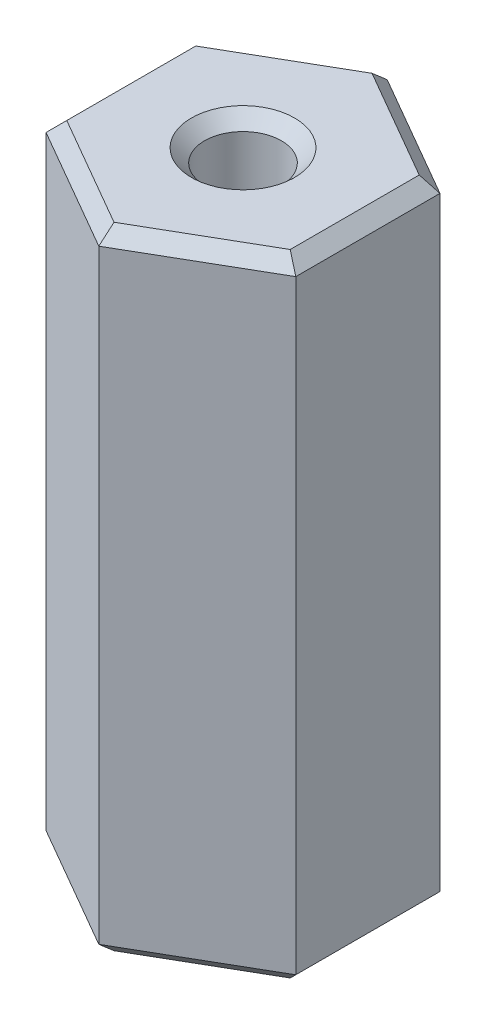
SolidWorks part; units mm, degrees
ref_plane "Plan de face" through (0, 0, 0) normal (0, 0, 1) x (1, 0, 0)
ref_plane "Plan de dessus" through (0, 0, 0) normal (0, 1, 0) x (1, 0, 0)
ref_plane "Plan de droite" through (0, 0, 0) normal (1, 0, 0) x (0, 0, -1)
sketch "Esquisse1" plane through (0, 0, 0) normal (0, 0, 1) x (1, 0, 0)
  line L0 (0, 0) -> (0, 12.4178) construction
  line L1 (-12.925, 0) -> (-2.925, 0)
  line L2 (-2.925, 0) -> (-2.925, 20)
  line L3 (-2.925, 20) -> (0, 22.925)
  line L4 (0, 22.925) -> (0, 25.075)
  line L5 (0, 25.075) -> (-2.925, 28)
  line L6 (-2.925, 28) -> (-2.925, 48)
  line L7 (-2.925, 48) -> (-12.925, 48)
  line L8 (-12.925, 48) -> (-12.925, 0)
  dimension "D1" = 5.85
  dimension "D2" = 5.85
  dimension "D3" = 20
  dimension "D4" = 48
  dimension "D5" = 20
  dimension "D6" = 45
  dimension "D7" = 10
  dimension "D8" = 25.85
revolve "Révolution1" add sketch "Esquisse1" angle 360 about L0
sketch "Esquisse2" plane through (0, 48, 0) normal (0, 1, 0) x (1, 0, 0)
  line L1 (0, 10.9697) -> (-9.5, 5.4848)
  line L2 (-9.5, 5.4848) -> (-9.5, -5.4848)
  line L3 (-9.5, -5.4848) -> (0, -10.9697)
  line L4 (0, -10.9697) -> (9.5, -5.4848)
  line L5 (9.5, -5.4848) -> (9.5, 5.4848)
  line L6 (9.5, 5.4848) -> (0, 10.9697)
  circle A0 centre (0, 0) radius 9.5 construction
  dimension "D1" = 19
extrude "Enlèv. mat.-Extru.1" cut sketch "Esquisse2" against normal through all both and the other way through all flip side to cut
chamfer "Chanfrein1" distance 1 angle 45 14 edges at (0, 0, -2.925) (0, 48, -2.925) (-4.75, 0, -8.2272) (-9.5, 0, 0) (-4.75, 0, 8.2272) (4.75, 0, 8.2272) (9.5, 0, 0) (4.75, 0, -8.2272) (9.5, 48, 0) (4.75, 48, 8.2272) (-4.75, 48, 8.2272) (-9.5, 48, 0) (-4.75, 48, -8.2272) (4.75, 48, -8.2272)
